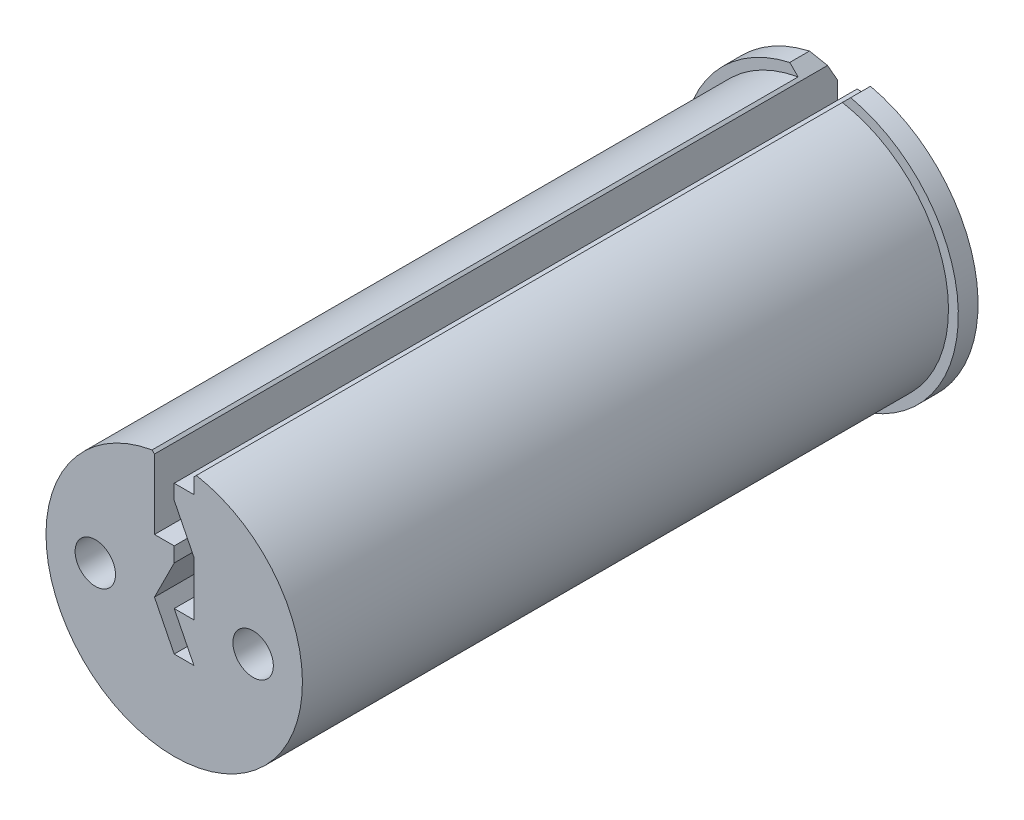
SolidWorks part; units mm, degrees
ref_plane "Plan de face" through (0, 0, 0) normal (0, 0, 1) x (1, 0, 0)
ref_plane "Plan de dessus" through (0, 0, 0) normal (0, 1, 0) x (1, 0, 0)
ref_plane "Plan de droite" through (0, 0, 0) normal (1, 0, 0) x (0, 0, -1)
sketch "Esquisse1" plane through (0, 0, 0) normal (1, 0, 0) x (0, 0, -1)
  line L1 (44, 6.5) -> (11.5, 6.5)
  line L2 (44, 6.5) -> (44, 7)
  line L3 (45, 7) -> (45.866, 5.5)
  line L4 (45.866, 5.5) -> (45.866, 0)
  line L5 (0, 0) -> (46.6909, 0) construction
  line L6 (-2, -6.5) -> (23, -6.5) construction
  line L7 (45, 7) -> (44, 7) construction
  line L8 (11.5, 6.5) -> (11.5, 0) construction
  line L9 (11.5, 0) -> (45.866, 0)
  line L10 (44, 7) -> (45, 7)
  line L11 (11.25, 0) -> (11.25, 6.5)
  line L12 (11.25, 6.5) -> (11.5, 6.5)
  line L13 (11.25, 0) -> (11.5, 0)
  dimension "D1" = 120
  dimension "D2" = 1.5
  dimension "D3" = 0.25
  dimension "D4" = 33.5
revolve "Révolution1" add sketch "Esquisse1" angle 360 about L5
ref_plane "Plan1" through (0, -6.5, 0) normal (0, -1, 0) x (1, 0, 0)
sketch "Esquisse5" plane through (0, 0, -45.866) normal (0, 0, -1) x (-1, 0, 0)
  line L0 (0, 0) -> (0, 4) construction
  line L1 (-1, 6.9282) -> (-1, 5.5)
  line L2 (1, 6.9282) -> (1, 2.75)
  line L3 (0, 0) -> (-1, 0)
  line L4 (0, 0) -> (-1, -2)
  line L5 (-1, -2) -> (0, -2)
  line L6 (0, -2) -> (1, 0)
  line L7 (0, 2) -> (0, 2.75)
  line L8 (1, 0) -> (0, 0) construction
  line L9 (1, 0) -> (0, 2)
  line L10 (0, 2.75) -> (1, 2.75)
  line L11 (-1, 2.75) -> (0, 4.75)
  line L12 (0, 4.75) -> (0, 5.5)
  line L13 (0, 5.5) -> (-1, 5.5)
  line L14 (-1, 2.75) -> (-1, 0)
  line L15 (0, 0) -> (0, -7) construction
  circle A0 centre (0, 0) radius 7 construction
  arc A1 (1, 6.9282) -> (-1, 6.9282) centre (0, 0) ccw
  circle A3 centre (0, 0) radius 6.5 construction
  circle A4 centre (0, 0) radius 6.5 construction
  point P20 (0, 6.5)
  point P21 (0, -7)
  dimension "D2" = 2
  dimension "D1" = 2
  dimension "D3" = 2
  dimension "D4" = 0.75
  dimension "D5" = 1
extrude "Enlèv. mat.-Extru.2" cut sketch "Esquisse5" against normal through all
sketch "Esquisse2" plane through (0, -6.5, 0) normal (0, -1, 0) x (1, 0, 0)
  circle A0 centre (0, -24.5) radius 1.5 construction
  circle A1 centre (0, -28.5) radius 1.5 construction
  circle A2 centre (0, -32.5) radius 1.5 construction
  circle A3 centre (0, -36.5) radius 1.5 construction
  circle A4 centre (0, -40.5) radius 1.5 construction
  circle A5 centre (0, -24.5) radius 1.5
  circle A6 centre (0, -28.5) radius 1.5
  circle A7 centre (0, -32.5) radius 1.5
  circle A8 centre (0, -36.5) radius 1.5
  circle A9 centre (0, -40.5) radius 1.5
extrude "Enlèv. mat.-Extru.1" cut sketch "Esquisse2" against normal up to surface (6.5 mm away)
hole_wizard "Trou taraudé M2.5x0.451" positions "Esquisse4" profile "Esquisse3" tap size "M2.5x0.45" standard "Ansi Métrique"
sketch "Esquisse4" plane through (2.589, -3.7043, -11.25) normal (0, 0, 1) x (1, 0, 0)
  line L0 (-6.589, 3.7043) -> (1.411, 3.7043) construction
  point P0 (-6.589, 3.7043)
  point P10 (1.411, 3.7043)
  dimension "D1" = 8
sketch "Esquisse3" plane through (-4, 0, -11.25) normal (1, 0, 0) x (0, -1, 0)
  line L0 (0, 0) -> (0, 10.6159)
  line L1 (0, 10.6159) -> (1.025, 10)
  line L2 (1.025, 10) -> (1.025, 0)
  line L5 (1.025, 0) -> (0, 0)
  line L10 (0, 10.6159) -> (-1.025, 10) construction
  line L11 (0, -6.35) -> (0, 107.95) construction
  dimension "Diamètre du trou pour taraudage" = 2.05
  dimension "Profondeur du trou pour taraudage" = 10
  dimension "Angle de pointe" = 118
sketch "Esquisse6" plane through (0, 0, -45.866) normal (0, 0, -1) x (-1, 0, 0)
  line L0 (-0.7188, 6) -> (0.7188, 6)
  line L1 (0.7188, 6) -> (3.7188, 9)
  line L2 (3.7188, 9) -> (-3.7188, 9)
  line L3 (-3.7188, 9) -> (-0.7188, 6)
  line L4 (0, 0) -> (0, 6) construction
  line L5 (0, 5.5) -> (-1, 5.5) construction
  dimension "D1" = 3
  dimension "D2" = 0.5
  dimension "D3" = 45
  dimension "D4" = 0.1
  dimension "D5" = 45
extrude "Enlèv. mat.-Extru.3" cut sketch "Esquisse6" against normal through all
chamfer "Chanfrein1" distance 0.25 angle 45 5 edges at (0.3008, -6.493, -39.0305) (0.3008, -6.493, -35.0305) (0.3008, -6.493, -31.0305) (0.3008, -6.493, -27.0305) (0.3008, -6.493, -23.0305)
